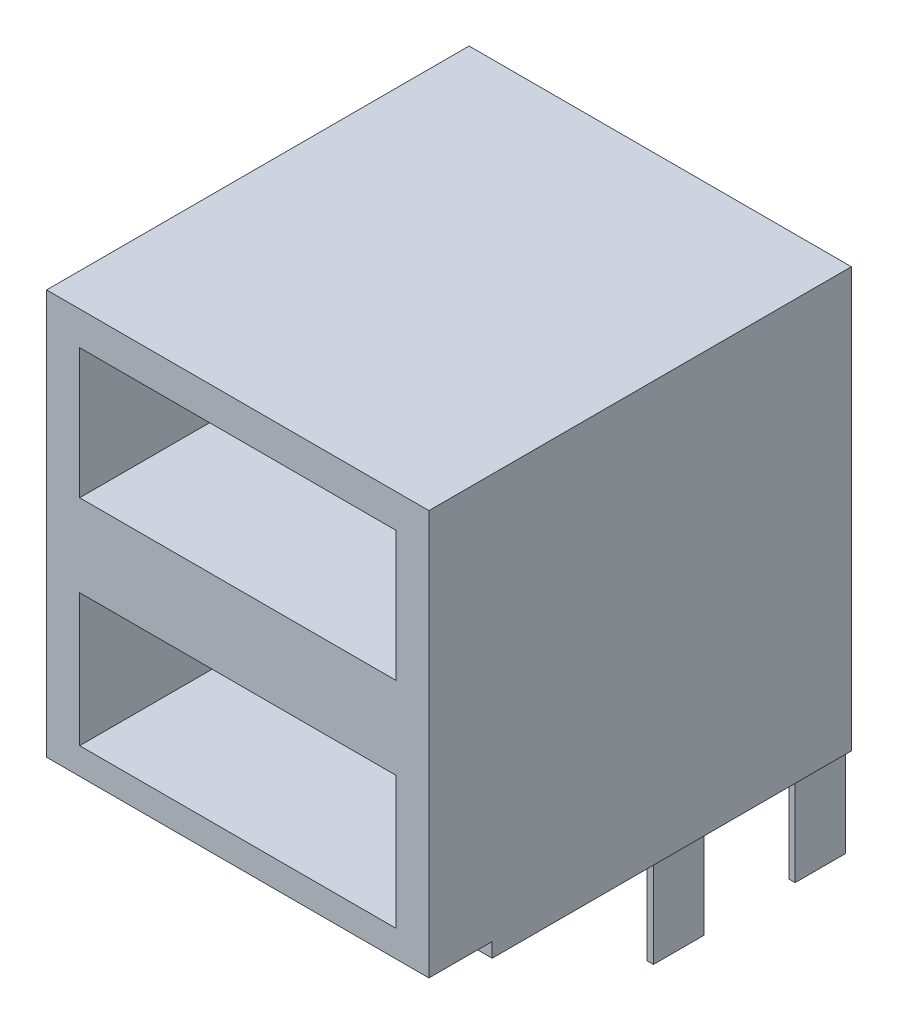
SolidWorks part; units mm, degrees
ref_plane "Front Plane" through (0, 0, 0) normal (0, 0, 1) x (1, 0, 0)
ref_plane "Top Plane" through (0, 0, 0) normal (0, 1, 0) x (1, 0, 0)
ref_plane "Right Plane" through (0, 0, 0) normal (1, 0, 0) x (0, 0, -1)
imported_body "Imported1"
other "NONE"
